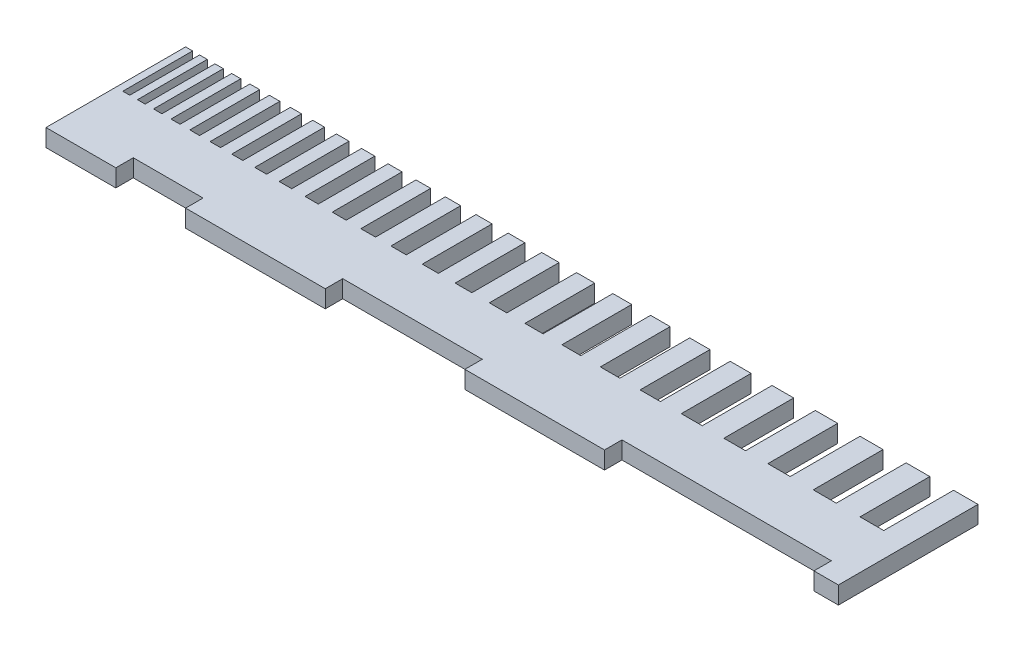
SolidWorks part; units mm, degrees
ref_plane "Front Plane" through (0, 0, 0) normal (0, 0, 1) x (1, 0, 0)
ref_plane "Top Plane" through (0, 0, 0) normal (0, 1, 0) x (1, 0, 0)
ref_plane "Right Plane" through (0, 0, 0) normal (1, 0, 0) x (0, 0, -1)
sketch "Sketch1" plane through (0, 0, 0) normal (0, 1, 0) x (1, 0, 0)
  line L0 (2.54, 50.8) -> (2.54, 25.4)
  line L1 (0, 0) -> (25.4, 0)
  line L2 (0, 0) -> (0, 50.8)
  line L3 (0, 50.8) -> (2.54, 50.8)
  line L5 (5.08, 50.8) -> (5.08, 25.4)
  line L6 (7.874, 50.8) -> (7.874, 25.4)
  line L7 (10.668, 50.8) -> (10.668, 25.4)
  line L8 (13.716, 50.8) -> (13.716, 25.4)
  line L9 (16.764, 50.8) -> (16.764, 25.4)
  line L10 (20.066, 50.8) -> (20.066, 25.4)
  line L11 (23.368, 50.8) -> (23.368, 25.4)
  line L12 (148.844, 50.8) -> (148.844, 25.4)
  line L13 (30.48, 50.8) -> (30.48, 25.4)
  line L14 (34.29, 50.8) -> (34.29, 25.4)
  line L15 (205.74, 50.8) -> (205.74, 25.4)
  line L16 (213.36, 50.8) -> (213.36, 25.4)
  line L17 (26.924, 50.8) -> (26.924, 25.4)
  line L18 (38.1, 50.8) -> (38.1, 25.4)
  line L19 (42.164, 50.8) -> (42.164, 25.4)
  line L20 (162.306, 50.8) -> (162.306, 25.4)
  line L21 (155.448, 50.8) -> (155.448, 25.4)
  line L22 (190.754, 50.8) -> (190.754, 25.4)
  line L23 (169.164, 50.8) -> (169.164, 25.4)
  line L24 (83.82, 50.8) -> (83.82, 25.4)
  line L25 (183.388, 50.8) -> (183.388, 25.4)
  line L26 (176.276, 50.8) -> (176.276, 25.4)
  line L27 (198.12, 50.8) -> (198.12, 25.4)
  line L28 (229.108, 50.8) -> (229.108, 25.4)
  line L29 (64.008, 50.8) -> (64.008, 25.4)
  line L30 (237.236, 50.8) -> (237.236, 25.4)
  line L31 (245.364, 50.8) -> (245.364, 25.4)
  line L32 (54.864, 50.8) -> (54.864, 25.4)
  line L33 (221.234, 50.8) -> (221.234, 25.4)
  line L34 (46.228, 50.8) -> (46.228, 25.4)
  line L35 (50.546, 50.8) -> (50.546, 25.4)
  line L36 (89.154, 50.8) -> (89.154, 25.4)
  line L37 (262.128, 50.8) -> (262.128, 25.4)
  line L38 (135.89, 50.8) -> (135.89, 25.4)
  line L39 (73.66, 50.8) -> (73.66, 25.4)
  line L40 (2.54, 25.4) -> (5.08, 25.4)
  line L41 (117.348, 50.8) -> (117.348, 25.4)
  line L42 (253.746, 50.8) -> (253.746, 25.4)
  line L43 (288.29, 50.8) -> (288.29, 20.2846)
  line L44 (94.488, 50.8) -> (94.488, 25.4)
  line L45 (105.664, 50.8) -> (105.664, 25.4)
  line L46 (111.506, 50.8) -> (111.506, 25.4)
  line L47 (270.764, 50.8) -> (270.764, 25.4)
  line L48 (78.74, 50.8) -> (78.74, 25.4)
  line L49 (279.4, 50.8) -> (279.4, 25.4)
  line L50 (288.29, 20.2846) -> (288.29, 0)
  line L51 (7.874, 25.4) -> (10.668, 25.4)
  line L52 (100.076, 50.8) -> (100.076, 25.4)
  line L53 (13.716, 25.4) -> (16.764, 25.4)
  line L54 (123.444, 50.8) -> (123.444, 25.4)
  line L55 (20.066, 25.4) -> (23.368, 25.4)
  line L56 (26.924, 25.4) -> (30.48, 25.4)
  line L57 (34.29, 25.4) -> (38.1, 25.4)
  line L58 (142.24, 50.8) -> (142.24, 25.4)
  line L59 (42.164, 25.4) -> (46.228, 25.4)
  line L60 (50.546, 25.4) -> (54.864, 25.4)
  line L61 (59.436, 50.8) -> (59.436, 25.4)
  line L62 (59.436, 25.4) -> (64.008, 25.4)
  line L63 (68.834, 25.4) -> (73.66, 25.4)
  line L64 (78.74, 25.4) -> (83.82, 25.4)
  line L65 (89.154, 25.4) -> (94.488, 25.4)
  line L66 (68.834, 50.8) -> (68.834, 25.4)
  line L67 (129.54, 50.8) -> (129.54, 25.4)
  line L68 (100.076, 25.4) -> (105.664, 25.4)
  line L69 (111.506, 25.4) -> (117.348, 25.4)
  line L70 (123.444, 25.4) -> (129.54, 25.4)
  line L71 (135.89, 25.4) -> (142.24, 25.4)
  line L72 (148.844, 25.4) -> (155.448, 25.4)
  line L73 (162.306, 25.4) -> (169.164, 25.4)
  line L74 (176.276, 25.4) -> (183.388, 25.4)
  line L75 (190.754, 25.4) -> (198.12, 25.4)
  line L76 (205.74, 25.4) -> (213.36, 25.4)
  line L77 (221.234, 25.4) -> (229.108, 25.4)
  line L78 (237.236, 25.4) -> (245.364, 25.4)
  line L79 (253.746, 25.4) -> (262.128, 25.4)
  line L80 (270.764, 25.4) -> (279.4, 25.4)
  line L81 (5.08, 50.8) -> (7.874, 50.8)
  line L82 (10.668, 50.8) -> (13.716, 50.8)
  line L83 (16.764, 50.8) -> (20.066, 50.8)
  line L84 (23.368, 50.8) -> (26.924, 50.8)
  line L85 (30.48, 50.8) -> (34.29, 50.8)
  line L86 (38.1, 50.8) -> (42.164, 50.8)
  line L87 (46.228, 50.8) -> (50.546, 50.8)
  line L88 (54.864, 50.8) -> (59.436, 50.8)
  line L89 (64.008, 50.8) -> (68.834, 50.8)
  line L90 (73.66, 50.8) -> (78.74, 50.8)
  line L91 (83.82, 50.8) -> (89.154, 50.8)
  line L92 (94.488, 50.8) -> (100.076, 50.8)
  line L93 (105.664, 50.8) -> (111.506, 50.8)
  line L94 (117.348, 50.8) -> (123.444, 50.8)
  line L95 (129.54, 50.8) -> (135.89, 50.8)
  line L96 (142.24, 50.8) -> (148.844, 50.8)
  line L97 (155.448, 50.8) -> (162.306, 50.8)
  line L98 (169.164, 50.8) -> (176.276, 50.8)
  line L99 (183.388, 50.8) -> (190.754, 50.8)
  line L100 (198.12, 50.8) -> (205.74, 50.8)
  line L101 (213.36, 50.8) -> (221.234, 50.8)
  line L102 (229.108, 50.8) -> (237.236, 50.8)
  line L103 (245.364, 50.8) -> (253.746, 50.8)
  line L104 (262.128, 50.8) -> (270.764, 50.8)
  line L105 (279.4, 50.8) -> (288.29, 50.8)
  line L106 (25.4, 0) -> (25.4, 6.35)
  line L107 (25.4, 6.35) -> (50.8, 6.35)
  line L108 (50.8, 6.35) -> (50.8, 0)
  line L109 (101.6, 0) -> (101.6, 6.35)
  line L110 (101.6, 6.35) -> (152.4, 6.35)
  line L111 (152.4, 6.35) -> (152.4, 0)
  line L112 (152.4, 0) -> (203.2, 0)
  line L113 (203.2, 0) -> (203.2, 6.35)
  line L114 (203.2, 6.35) -> (279.4, 6.35)
  line L115 (279.4, 6.35) -> (279.4, 0)
  line L116 (50.8, 0) -> (101.6, 0)
  line L117 (152.4, 0) -> (203.2, 0)
  line L118 (279.4, 0) -> (288.29, 0)
  dimension "D1" = 50.8
  dimension "D3" = 2.54
  dimension "D4" = 2.54
  dimension "D5" = 2.794
  dimension "D6" = 2.794
  dimension "D7" = 3.048
  dimension "D8" = 3.048
  dimension "D9" = 3.302
  dimension "D10" = 3.302
  dimension "D11" = 3.556
  dimension "D12" = 3.556
  dimension "D13" = 3.81
  dimension "D14" = 3.81
  dimension "D15" = 4.064
  dimension "D16" = 4.064
  dimension "D17" = 4.318
  dimension "D18" = 4.318
  dimension "D19" = 4.572
  dimension "D20" = 4.572
  dimension "D21" = 4.826
  dimension "D22" = 4.826
  dimension "D23" = 5.08
  dimension "D24" = 5.08
  dimension "D25" = 5.334
  dimension "D26" = 5.334
  dimension "D27" = 5.588
  dimension "D28" = 5.588
  dimension "D29" = 5.842
  dimension "D30" = 5.842
  dimension "D31" = 6.096
  dimension "D32" = 6.096
  dimension "D33" = 6.35
  dimension "D34" = 6.35
  dimension "D35" = 6.604
  dimension "D36" = 6.604
  dimension "D37" = 6.858
  dimension "D38" = 6.858
  dimension "D39" = 7.112
  dimension "D40" = 7.112
  dimension "D41" = 7.366
  dimension "D42" = 7.366
  dimension "D43" = 7.62
  dimension "D44" = 7.62
  dimension "D45" = 7.874
  dimension "D46" = 7.874
  dimension "D47" = 8.128
  dimension "D48" = 8.128
  dimension "D49" = 8.382
  dimension "D50" = 8.382
  dimension "D51" = 8.636
  dimension "D52" = 8.636
  dimension "D53" = 8.89
  dimension "D54" = 288.29
  dimension "D55" = 25.4
  dimension "D56" = 25.4
  dimension "D57" = 6.35
  dimension "D58" = 25.4
  dimension "D59" = 50.8
  dimension "D60" = 76.2
  dimension "D61" = 50.8
  dimension "D62" = 50.8
extrude "Boss-Extrude1" add sketch "Sketch1" along normal blind 6.35 contours L115 L118 L50 L43 L105 L49 L80 L47 L104 L37 L79 L42 L103 L31 L78 L30 L102 L28 L77 L33 L101 L16 L76 L15 L100 L27 L75 L22 L99 L25 L74 L26 L98 L23 L73 L20 L97 L21 L72 L12 L96 L58 L71 L38 L95 L67 L70 L54 L94 L41 L69
